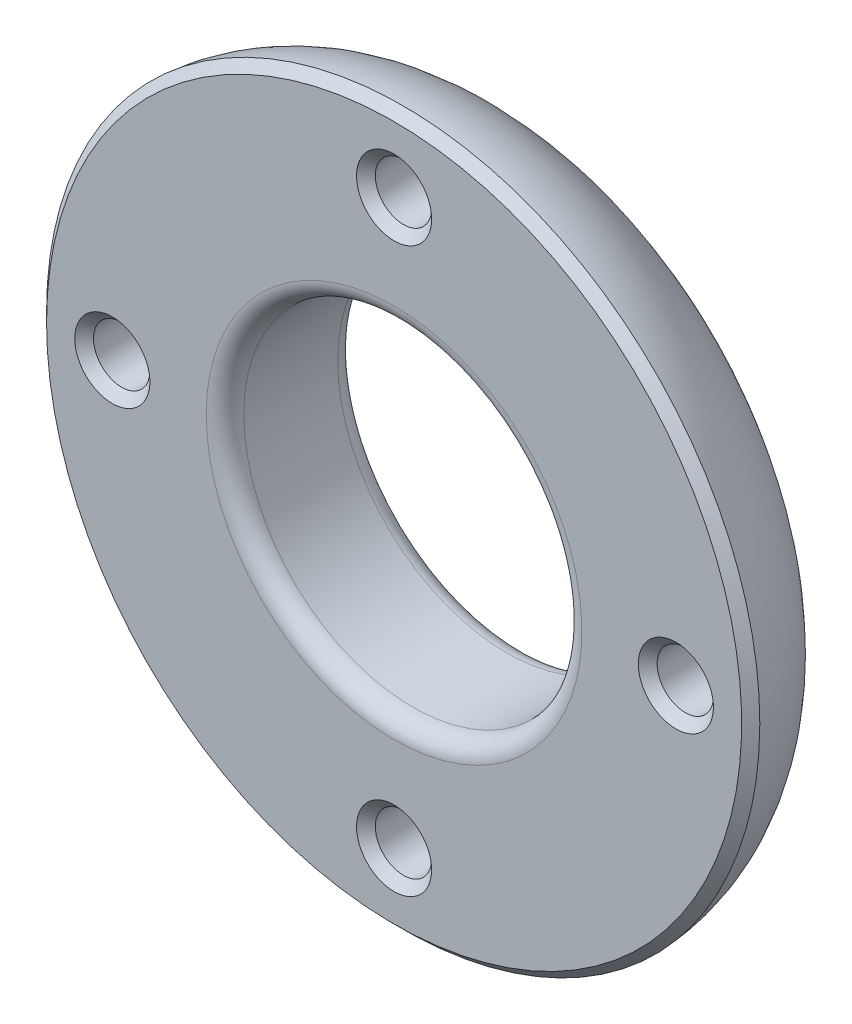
SolidWorks part; units mm, degrees
ref_plane "Спереди" through (0, 0, 0) normal (0, 0, 1) x (1, 0, 0)
ref_plane "Сверху" through (0, 0, 0) normal (0, 1, 0) x (1, 0, 0)
ref_plane "Справа" through (0, 0, 0) normal (1, 0, 0) x (0, 0, -1)
sketch "Эскиз1" plane through (0, 0, 0) normal (1, 0, 0) x (0, 0, -1)
  line L0 (-1.75, 0) -> (1.75, 0) construction
  line L1 (1.75, 4.5) -> (-1.75, 4.5)
  line L2 (-1.75, 4.5) -> (-1.75, 9.5)
  line L3 (1.75, 4.5) -> (1.75, 6)
  arc A0 (1.75, 6) -> (-1.75, 9.5) centre (-1.75, 6) ccw
  dimension "D4" = 7
  dimension "D1" = 9
  dimension "D2" = 19
  dimension "D3" = 3.5
revolve "Повернуть1" add sketch "Эскиз1" angle 360 about L0
sketch "Эскиз2" plane through (0, 0, 1.75) normal (0, 0, 1) x (1, 0, 0)
  line L0 (0, 0) -> (0, 7.5) construction
  line L1 (0, 0) -> (7.5, 0) construction
  circle A0 centre (0, 0) radius 7.5 construction
  circle A1 centre (0, 7.5) radius 0.75
  circle A2 centre (7.5, 0) radius 0.75
  circle A3 centre (0, -7.5) radius 0.75
  circle A4 centre (-7.5, 0) radius 0.75
  dimension "D1" = 15
  dimension "D2" = 1.5
extrude "Вырез-Вытянуть1" cut sketch "Эскиз2" against normal blind 2.5
fillet "Скругление1" radius 0.5 2 edges at (4.5, 0, 1.75) (4.5, 0, -1.75)
chamfer "Фаска1" distance 0.25 angle 45 9 edges at (0.75, -7.5, 1.75) (0.75, -7.5, -0.75) (8.25, 0, 1.75) (8.25, 0, -0.75) (-6.75, 0, 1.75) (-6.75, 0, -0.75) (0.75, 7.5, 1.75) (0.75, 7.5, -0.75) (9.5, 0, 1.75)
